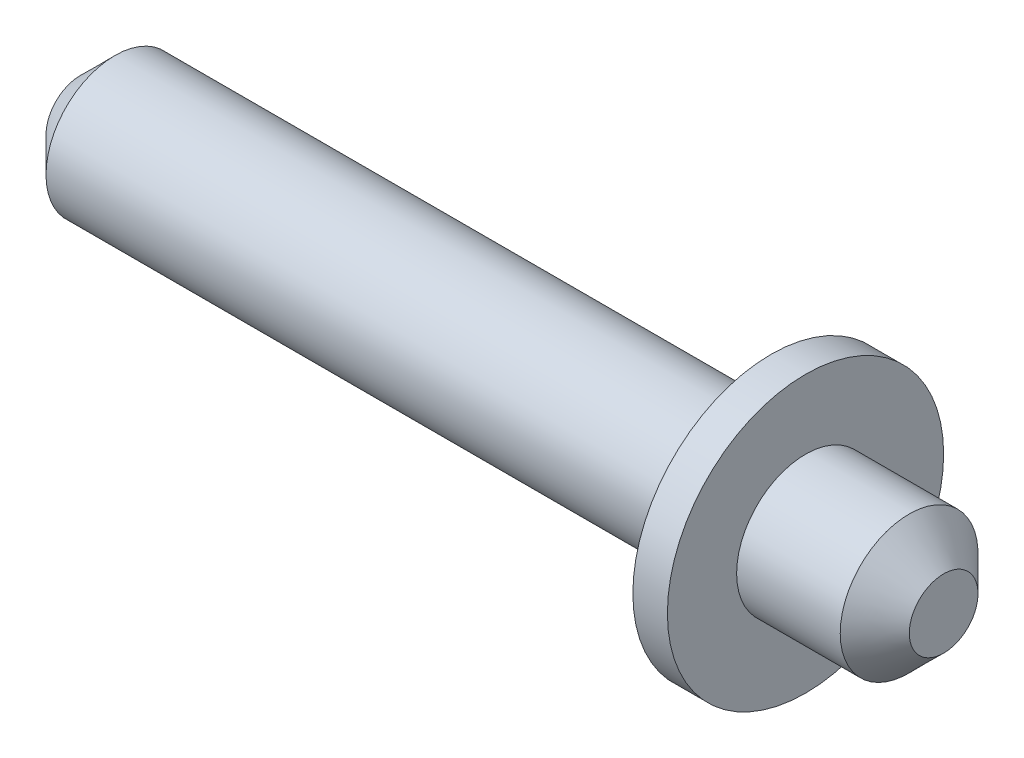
SolidWorks part; units mm, degrees
ref_plane "Front Plane" through (0, 0, 0) normal (0, 0, 1) x (1, 0, 0)
ref_plane "Top Plane" through (0, 0, 0) normal (0, 1, 0) x (1, 0, 0)
ref_plane "Right Plane" through (0, 0, 0) normal (1, 0, 0) x (0, 0, -1)
sketch "Sketch3" plane through (0, 0, 0) normal (0, 0, 1) x (1, 0, 0)
  line L0 (0, 0) -> (0, 1.995)
  line L1 (0, 1.995) -> (20, 1.995)
  line L2 (20, 1.995) -> (20, 4)
  line L3 (20, 4) -> (21, 4)
  line L4 (21, 4) -> (21, 1.995)
  line L5 (0, 0) -> (21, 0) construction
  line L6 (0, 0) -> (21, 0)
  line L7 (21, 1.995) -> (25, 1.995)
  line L8 (25, 1.995) -> (25, 0)
  line L9 (25, 0) -> (21, 0)
  dimension "D1" = 3.99
  dimension "D2" = 1
  dimension "D3" = 8
  dimension "D4" = 20
  dimension "D5" = 4
revolve "Revolve1" add sketch "Sketch3" angle 360 about L5
chamfer "Chamfer1" distance 1 angle 45 2 edges at (0, 0, 1.995) (25, 0, 1.995)
